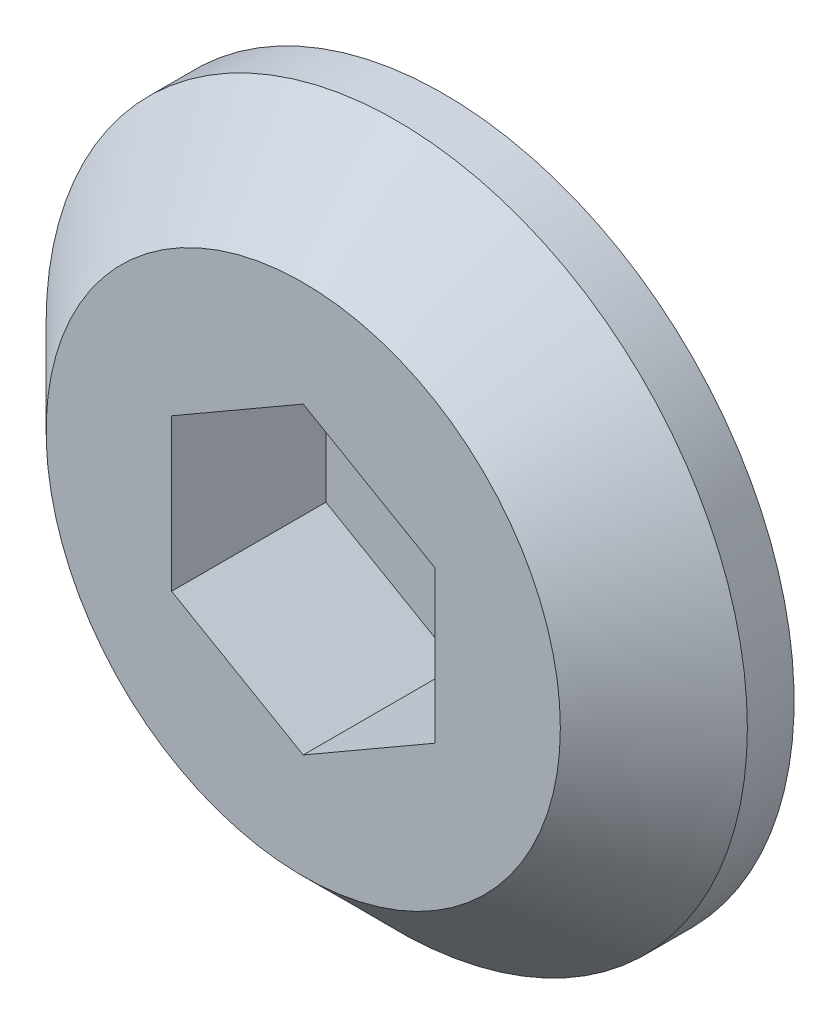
SolidWorks part; units mm, degrees
ref_plane "Alzado" through (0, 0, 0) normal (0, 0, 1) x (1, 0, 0)
ref_plane "Planta" through (0, 0, 0) normal (0, 1, 0) x (1, 0, 0)
ref_plane "Vista lateral" through (0, 0, 0) normal (1, 0, 0) x (0, 0, -1)
sketch "Croquis1" plane through (0, 0, 0) normal (0, 0, 1) x (1, 0, 0)
  circle A0 centre (0, 0) radius 7.5
  dimension "D1" = 15
extrude "Saliente-Extruir1" add sketch "Croquis1" along normal mid plane 5
chamfer "Chaflán1" distance 2 angle 45 1 edges at (7.5, 0, 2.5)
sketch "Croquis2" plane through (0, 0, 2.5) normal (0, 0, 1) x (1, 0, 0)
  line L1 (0, -3.25) -> (2.8146, -1.625)
  line L2 (2.8146, -1.625) -> (2.8146, 1.625)
  line L3 (2.8146, 1.625) -> (0, 3.25)
  line L4 (0, 3.25) -> (-2.8146, 1.625)
  line L5 (-2.8146, 1.625) -> (-2.8146, -1.625)
  line L6 (-2.8146, -1.625) -> (0, -3.25)
  circle A0 centre (0, 0) radius 2.8146 construction
  dimension "D1" = 6.5
extrude "Cortar-Extruir1" cut sketch "Croquis2" against normal blind 3.3
sketch "Croquis3" plane through (0, 0, -0.8) normal (0, 0, 1) x (1, 0, 0)
  circle A0 centre (0, 0) radius 1.55
  dimension "D1" = 3.1
extrude "Cortar-Extruir2" cut sketch "Croquis3" against normal through all
sketch "Croquis4" plane through (0, 0, -2.5) normal (0, 0, -1) x (-1, 0, 0)
  circle A0 centre (0, 0) radius 3.875
  circle A1 centre (0, 0) radius 7.5
  circle A2 centre (0, 0) radius 7.5 construction
  dimension "D1" = 7.75
extrude "Cortar-Extruir3" cut sketch "Croquis4" against normal blind 2
